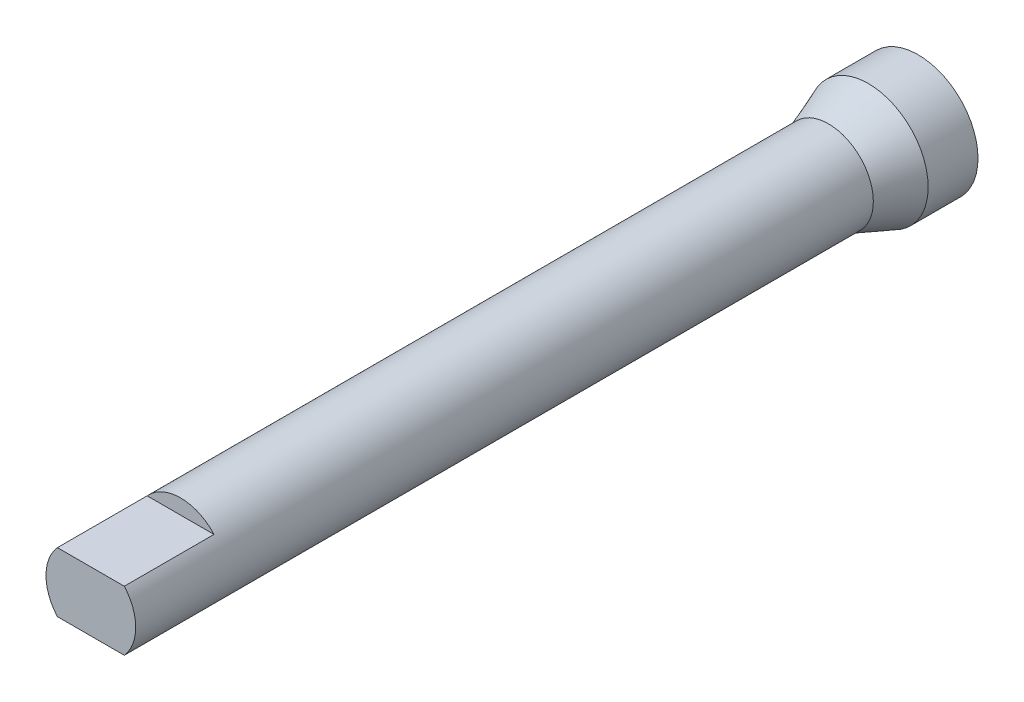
SolidWorks part; units mm, degrees
ref_plane "Front Plane" through (0, 0, 0) normal (0, 0, 1) x (1, 0, 0)
ref_plane "Top Plane" through (0, 0, 0) normal (0, 1, 0) x (1, 0, 0)
ref_plane "Right Plane" through (0, 0, 0) normal (1, 0, 0) x (0, 0, -1)
sketch "Sketch2" plane through (0, 0, 0) normal (0, 1, 0) x (1, 0, 0)
  line L0 (-30, 0) -> (0, 0) construction
  line L1 (-30, 0) -> (-30, -25)
  line L2 (-30, -25) -> (-22.5, -45)
  line L3 (-30, 0) -> (-25, 0)
  line L4 (-25, 0) -> (-25, -25)
  line L5 (-25, -25) -> (-17.5, -45)
  line L6 (-17.5, -45) -> (-22.5, -45)
ref_axis "Axis1" through (0, 0, 47.25) along (0, 0, -1)
revolve "Revolve1" add sketch "Sketch2" angle 360 about axis through (0, 0, 47.25) along (0, 0, -1)
sketch "Sketch3" plane through (0, 0, 45) normal (0, 0, 1) x (1, 0, 0)
  circle A0 centre (0, 0) radius 17.5 construction
  circle A1 centre (0, 0) radius 22.5 construction
  circle A2 centre (0, 0) radius 17.5
  circle A3 centre (0, 0) radius 22.5
extrude "Boss-Extrude1" add sketch "Sketch3" along normal blind 320
sketch "Sketch4" plane through (0, 0, 365) normal (0, 0, 1) x (1, 0, 0)
  circle A0 centre (0, 0) radius 22.5 construction
  circle A1 centre (0, 0) radius 22.5
extrude "Boss-Extrude2" add sketch "Sketch4" along normal blind 50
sketch "Sketch5" plane through (0, 0, 415) normal (0, 0, 1) x (1, 0, 0)
  line L0 (-50, 15) -> (50, 15) construction
  line L1 (50, 15) -> (50, -15) construction
  line L2 (50, -15) -> (-50, -15) construction
  line L3 (-50, -15) -> (-50, 15) construction
  line L4 (-50, 15) -> (50, -15) construction
  line L5 (-50, -15) -> (50, 15) construction
  line L6 (24.75, 0) -> (-24.75, 0) construction
  line L7 (16.7705, 15) -> (-16.7705, 15)
  line L8 (16.7705, 15) -> (16.7705, 35)
  line L9 (16.7705, 35) -> (-16.7705, 35)
  line L10 (-16.7705, 15) -> (-16.7705, 35)
  line L11 (16.7705, -35) -> (-16.7705, -35)
  line L12 (-16.7705, -15) -> (-16.7705, -35)
  line L13 (16.7705, -15) -> (-16.7705, -15)
  line L14 (16.7705, -15) -> (16.7705, -35)
  circle A0 centre (0, 0) radius 22.5 construction
  circle A1 centre (0, 0) radius 22.5 construction
  point P2 (0, 0)
  dimension "D1" = 30
  dimension "D2" = 100
extrude "Cut-Extrude1" cut sketch "Sketch5" against normal blind 45
equation "\"wideTopWidth\"= 60mm"
equation "\"D1@Sketch2\"=\"wideTopWidth\"/2"
equation "\"tubeWidth\"= 45mm"
equation "\"wallThickness\"= 5mm"
equation "\"D4@Sketch2\"=\"tubeWidth\"/2"
equation "\"D5@Sketch2\"=\"wallThickness\""
equation "\"D7@Sketch2\"=\"wallThickness\""
equation "\"D6@Sketch2\"=\"wallThickness\""
equation "\"tubeFullLen\"= 370mm"
equation "\"D1@Boss-Extrude1\"=\"tubeFullLen\"-50"
equation "\"D1@Boss-Extrude2\"=50"
